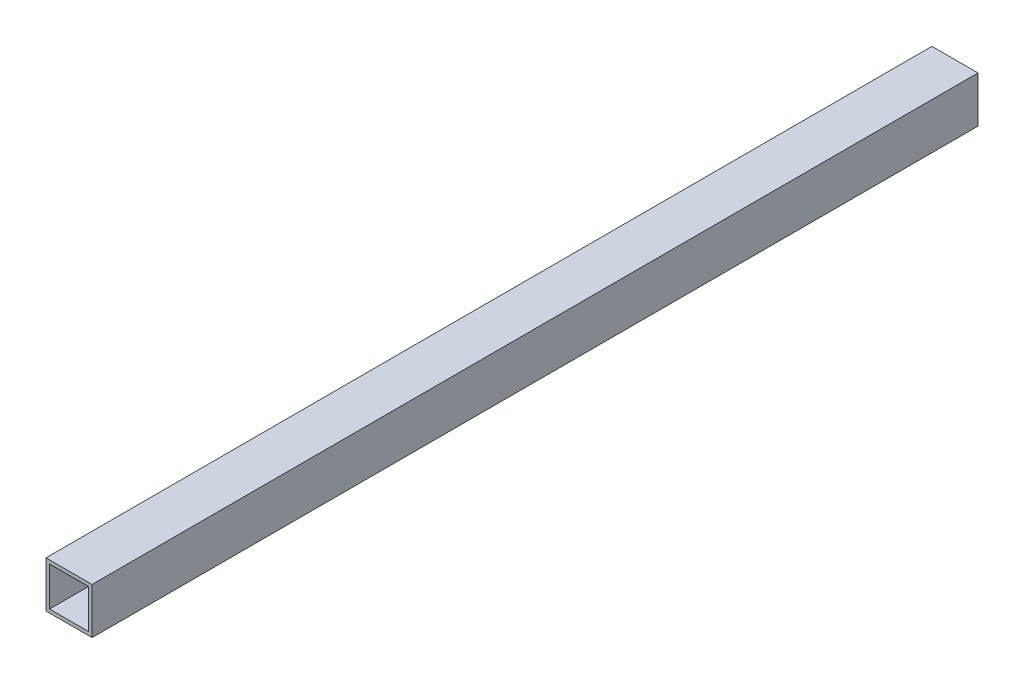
SolidWorks part; units mm, degrees
ref_plane "Alzado" through (0, 0, 0) normal (0, 0, 1) x (1, 0, 0)
ref_plane "Planta" through (0, 0, 0) normal (0, 1, 0) x (1, 0, 0)
ref_plane "Vista lateral" through (0, 0, 0) normal (1, 0, 0) x (0, 0, -1)
sketch "Sketch1" plane through (0, 0, 0) normal (0, 0, 1) x (1, 0, 0)
  line L1 (-13, 13) -> (13, 13)
  line L2 (-13, 13) -> (-13, -13)
  line L3 (-13, -13) -> (13, -13)
  line L4 (13, 13) -> (13, -13)
  line L5 (-13, 13) -> (13, -13) construction
  line L6 (-13, -13) -> (13, 13) construction
  line L7 (-11, 11) -> (11, 11)
  line L8 (-11, 11) -> (-11, -11)
  line L9 (-11, -11) -> (11, -11)
  line L10 (11, 11) -> (11, -11)
  line L11 (-11, 11) -> (11, -11) construction
  line L12 (-11, -11) -> (11, 11) construction
  point P0 (0, 0)
  point P6 (0, 0)
  dimension "D1" = 26
  dimension "D2" = 26
  dimension "D3" = 2
extrude "Boss-Extrude1" add sketch "Sketch1" along normal blind 500
